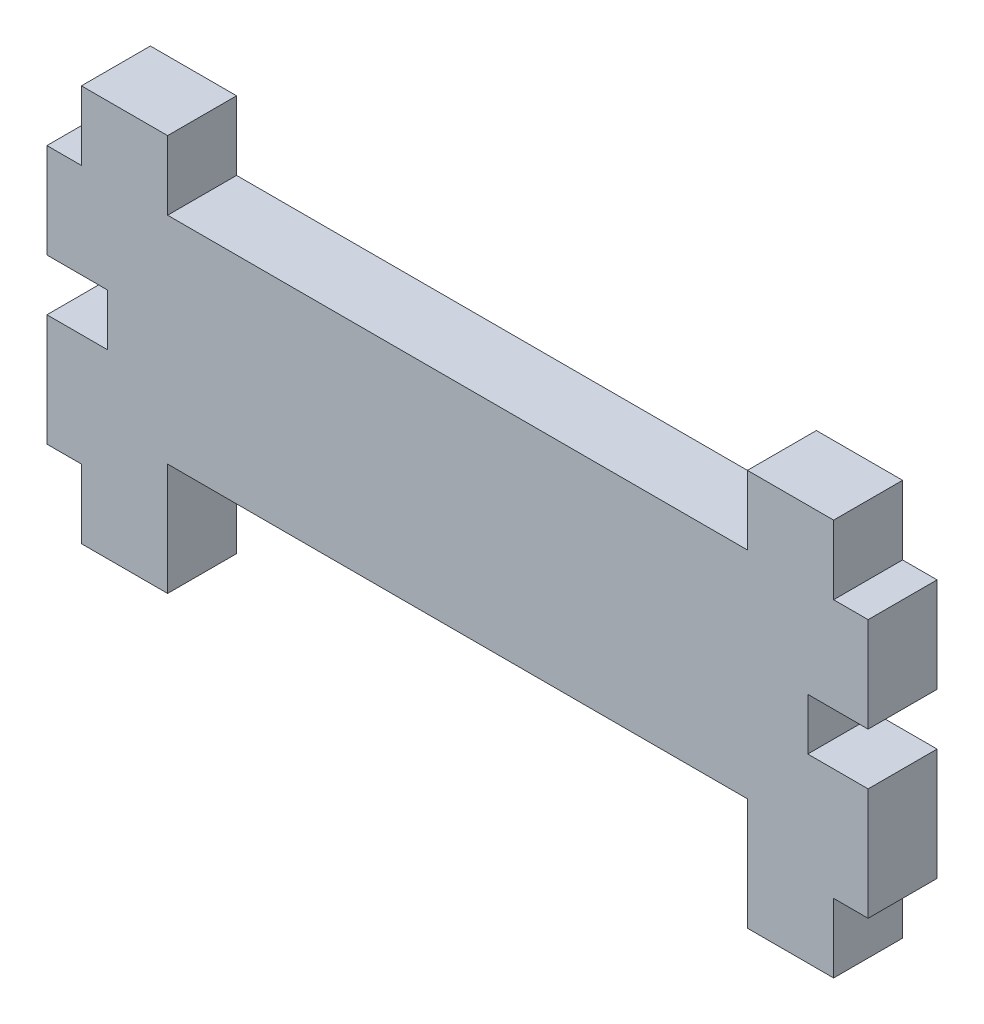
SolidWorks part; units mm, degrees
ref_plane "Alzado" through (0, 0, 0) normal (0, 0, 1) x (1, 0, 0)
ref_plane "Planta" through (0, 0, 0) normal (0, 1, 0) x (1, 0, 0)
ref_plane "Vista lateral" through (0, 0, 0) normal (1, 0, 0) x (0, 0, -1)
sketch "Croquis1" plane through (0, 0, 0) normal (0, 0, 1) x (1, 0, 0)
  line L0 (-10.5787, -2.3141) -> (-12.5787, -2.3141)
  line L1 (-10.5787, -17.3141) -> (-10.5787, -21.3141)
  line L2 (-10.5787, -21.3141) -> (-5.5787, -21.3141)
  line L3 (-5.5787, -21.3141) -> (-5.5787, -17.3141)
  line L4 (-5.5787, -17.3141) -> (-5.5787, -14.8141)
  line L5 (28.0513, -14.8141) -> (-5.5787, -14.8141)
  line L6 (33.0513, -2.3141) -> (33.0513, 1.6859)
  line L7 (33.0513, -2.3141) -> (35.0513, -2.3141)
  line L8 (28.0513, 1.6859) -> (28.0513, -2.3141)
  line L9 (33.0513, 1.6859) -> (28.0513, 1.6859)
  line L10 (-12.5787, -7.8141) -> (-12.5787, -2.3141)
  line L11 (-10.5787, 1.6859) -> (-5.5787, 1.6859)
  line L12 (-5.5787, 1.6859) -> (-5.5787, -2.3141)
  line L13 (35.0513, -17.3141) -> (35.0513, -10.8141)
  line L14 (28.0513, -17.3141) -> (28.0513, -14.8141)
  line L15 (28.0513, -21.3141) -> (28.0513, -17.3141)
  line L16 (-12.5787, -17.3141) -> (-10.5787, -17.3141)
  line L17 (-10.5787, -2.3141) -> (-10.5787, 1.6859)
  line L18 (35.0513, -17.3141) -> (33.0513, -17.3141)
  line L19 (28.0513, -2.3141) -> (-5.5787, -2.3141)
  line L20 (33.0513, -21.3141) -> (28.0513, -21.3141)
  line L21 (33.0513, -17.3141) -> (33.0513, -21.3141)
  line L22 (35.0513, -10.8141) -> (31.5513, -10.8141)
  line L23 (31.5513, -10.8141) -> (31.5513, -7.8141)
  line L24 (31.5513, -7.8141) -> (35.0513, -7.8141)
  line L25 (35.0513, -7.8141) -> (35.0513, -2.3141)
  line L27 (-9.0787, -7.8141) -> (-12.5787, -7.8141)
  line L28 (-9.0787, -10.8141) -> (-9.0787, -7.8141)
  line L29 (-12.5787, -10.8141) -> (-9.0787, -10.8141)
  line L30 (-12.5787, -17.3141) -> (-12.5787, -10.8141)
extrude "Saliente-Extruir1" add sketch "Croquis1" along normal blind 4
